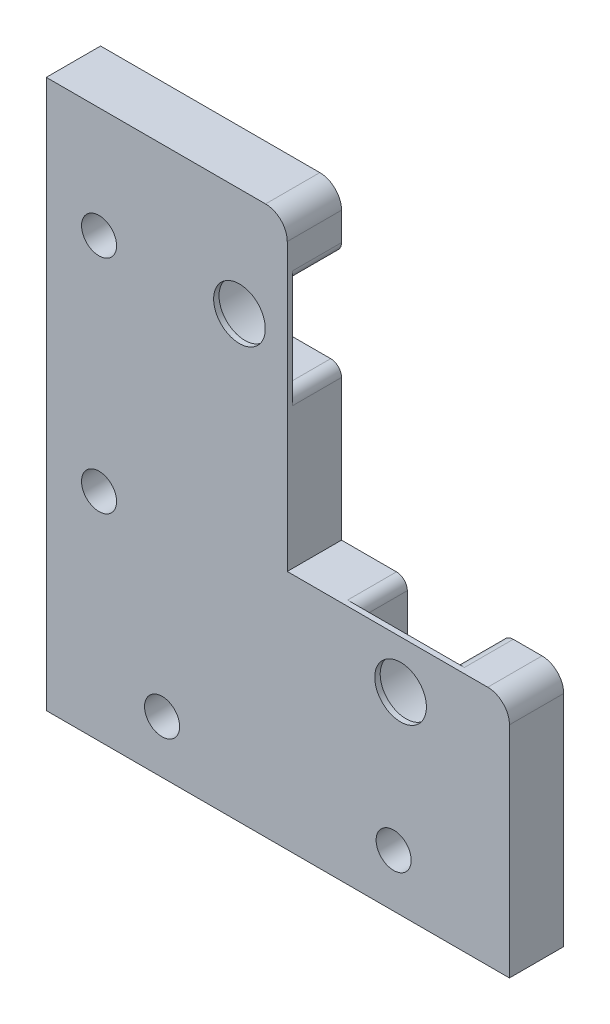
SolidWorks part; units mm, degrees
ref_plane "Front Plane" through (0, 0, 0) normal (0, 0, 1) x (1, 0, 0)
ref_plane "Top Plane" through (0, 0, 0) normal (0, 1, 0) x (1, 0, 0)
ref_plane "Right Plane" through (0, 0, 0) normal (1, 0, 0) x (0, 0, -1)
sketch "Sketch1" plane through (0, 0, 0) normal (0, 0, 1) x (1, 0, 0)
  line L6 (-810.8141, 612.9135) -> (-817.6657, 612.9135)
  line L7 (-810.8141, 612.9135) -> (-779.225, 612.9135)
  line L8 (-493.7649, 564.4955) -> (-493.7649, 1167.7963)
  line L9 (-493.7649, 1167.7963) -> (-817.6657, 1167.7963)
  line L10 (-817.6657, 1167.7963) -> (-817.6657, 564.4955)
  line L11 (-817.6657, 564.4955) -> (-493.7649, 564.4955)
  line L12 (-779.225, 612.9135) -> (-779.225, 571.3471)
  line L13 (-779.225, 571.3471) -> (-779.225, 564.4955)
  circle A2 centre (-798.6157, 583.5455) radius 2.667
extrude "Boss-Extrude1" add sketch "Sketch1" along normal blind 6.35 contours L13 L12 L7 L6 L10 L11 A2
sketch "Sketch2" plane through (0, 0, 6.35) normal (0, 0, 1) x (1, 0, 0)
  line L0 (-779.225, 564.4955) -> (-779.225, 555.0975)
  line L1 (-817.6657, 612.9135) -> (-827.0637, 612.9135)
  line L3 (-827.0637, 612.9135) -> (-779.225, 612.9135)
  line L4 (-779.225, 564.4955) -> (-779.225, 612.9135)
  line L5 (-779.225, 612.9135) -> (-817.6657, 612.9135)
  line L6 (-817.6657, 612.9135) -> (-817.6657, 564.4955)
  line L7 (-817.6657, 564.4955) -> (-779.225, 564.4955)
  line L8 (-779.225, 564.4955) -> (-779.225, 612.9135)
  line L9 (-779.225, 612.9135) -> (-817.6657, 612.9135)
  line L10 (-817.6657, 612.9135) -> (-817.6657, 564.4955)
  line L11 (-817.6657, 564.4955) -> (-779.225, 564.4955)
  line L12 (-827.0637, 612.9135) -> (-827.0637, 555.0975)
  line L13 (-827.0637, 555.0975) -> (-779.225, 555.0975)
  line L14 (-779.225, 612.9135) -> (-779.225, 555.0975)
  dimension "D2" = 9.398
  dimension "D1" = 0
extrude "Boss-Extrude2" add sketch "Sketch2" against normal up to vertex (996.0964 mm away) contours L12 L13 L0 L1 M15 M14
sketch "Sketch6" plane through (0, 0, 0) normal (0, 0, -1) x (-1, 0, 0)
  line L4 (779.225, 612.9135) -> (779.225, 555.0975)
  line L5 (779.225, 555.0975) -> (827.0637, 555.0975)
  line L6 (827.0637, 555.0975) -> (827.0637, 612.9135)
  line L7 (827.0637, 612.9135) -> (779.225, 612.9135)
  line L8 (779.225, 612.9135) -> (779.225, 555.0975)
  line L9 (779.225, 555.0975) -> (827.0637, 555.0975)
  line L10 (827.0637, 555.0975) -> (827.0637, 612.9135)
  line L11 (827.0637, 612.9135) -> (779.225, 612.9135)
  line L12 (804.9657, 562.1587) -> (817.4117, 562.1587)
  line L14 (819.1897, 562.1587) -> (820.0025, 562.1587)
  line L15 (820.0025, 562.1587) -> (820.0025, 612.9135)
  line L20 (817.4117, 562.1587) -> (819.1897, 562.1587)
  line L21 (804.9657, 562.1587) -> (779.225, 562.1587)
  dimension "D1" = 0
extrude "Boss-Extrude4" add sketch "Sketch6" along normal up to surface (78.0796 mm away) contours L12 L21 L8 L15 L14 L20 M11 M12 M13
sketch "Sketch7" plane through (0, 0, -78.0796) normal (0, 0, -1) x (-1, 0, 0)
  line L6 (805.2197, 576.9415) -> (805.2197, 612.9135)
  line L7 (779.225, 576.9415) -> (804.6609, 576.9415)
  line L8 (820.0025, 612.9135) -> (827.0637, 612.9135)
  line L9 (827.0637, 612.9135) -> (827.0637, 555.0975)
  line L10 (827.0637, 555.0975) -> (779.225, 555.0975)
  line L11 (779.225, 555.0975) -> (779.225, 562.1587)
  line L12 (779.225, 562.1587) -> (779.225, 576.9415)
  line L13 (820.0025, 612.9135) -> (805.2197, 612.9135)
  line L14 (804.6609, 576.9415) -> (805.2197, 576.9415)
  circle A2 centre (791.9609, 571.3471) radius 2.3812
  circle A3 centre (810.8141, 600.2587) radius 2.3812
sketch "Sketch8" plane through (0, 0, -78.0796) normal (0, 0, -1) x (-1, 0, 0)
  line L9 (805.2197, 612.9135) -> (805.2197, 576.9415)
  line L10 (820.0025, 612.9135) -> (805.2197, 612.9135)
  line L11 (827.0637, 612.9135) -> (820.0025, 612.9135)
  line L12 (827.0637, 555.0975) -> (827.0637, 612.9135)
  line L13 (779.225, 555.0975) -> (827.0637, 555.0975)
  line L14 (779.225, 562.1587) -> (779.225, 555.0975)
  line L15 (779.225, 576.9415) -> (779.225, 562.1587)
  line L16 (804.6609, 576.9415) -> (779.225, 576.9415)
  line L17 (805.2197, 576.9415) -> (804.6609, 576.9415)
  line L18 (805.2197, 612.9135) -> (805.2197, 576.9415)
  line L19 (820.0025, 612.9135) -> (805.2197, 612.9135)
  line L20 (827.0637, 612.9135) -> (820.0025, 612.9135)
  line L21 (827.0637, 555.0975) -> (827.0637, 612.9135)
  line L22 (779.225, 555.0975) -> (827.0637, 555.0975)
  line L23 (779.225, 562.1587) -> (779.225, 555.0975)
  line L24 (779.225, 576.9415) -> (779.225, 562.1587)
  line L25 (804.6609, 576.9415) -> (779.225, 576.9415)
  line L26 (805.2197, 576.9415) -> (804.6609, 576.9415)
  circle A1 centre (810.8141, 600.2587) radius 2.3813
  circle A2 centre (810.8141, 600.2587) radius 2.3812
  circle A3 centre (791.9609, 571.3471) radius 2.3813
  circle A4 centre (791.9609, 571.3471) radius 2.3812
  dimension "D1" = 0
  dimension "D2" = 0
  dimension "D3" = 0
extrude "Boss-Extrude6" add sketch "Sketch8" along normal blind 2.54
other "Cavity1"
other "5 SIDED ENCLOSURE 3 INCH.stp<1>@Assem11"
sketch "Sketch9" plane through (0, 612.9135, 0) normal (0, 1, 0) x (1, 0, 0)
  line L0 (-820.7645, 76.454) -> (-820.8153, 73.0504)
  line L1 (-820.8153, 3.1496) -> (-820.8153, 0)
  line L2 (-820.8153, 0) -> (-820.0025, 0)
  line L3 (-820.0025, 76.454) -> (-820.0025, 78.0796)
  line L4 (-820.0025, 78.0796) -> (-820.0025, 0)
  line L5 (-820.8153, 0) -> (-821.0693, 0)
  line L6 (-821.0693, 0) -> (-821.0693, 78.0796)
  line L7 (-821.0693, 78.0796) -> (-820.7645, 78.0796)
  line L12 (-820.7645, 76.454) -> (-820.7645, 78.0796)
  line L13 (-820.7645, 78.0796) -> (-805.2197, 78.0796)
  line L14 (-805.2197, 78.0796) -> (-805.2197, 80.6196)
  line L15 (-805.2197, 80.6196) -> (-827.0637, 80.6196)
  line L16 (-827.0637, 80.6196) -> (-827.0637, -6.35)
  line L17 (-827.0637, -6.35) -> (-779.225, -6.35)
  line L18 (-779.225, -6.35) -> (-779.225, 0)
  line L19 (-779.225, 0) -> (-820.0025, 0)
  line L20 (-820.0025, 0) -> (-820.0025, 1.0379)
  line L21 (-820.8153, 3.1496) -> (-820.8153, 73.0504)
  line L22 (-820.0025, 75.1621) -> (-820.0025, 76.454)
  line L23 (-820.0025, 76.454) -> (-820.7645, 76.454)
  line L24 (-820.7645, 76.454) -> (-820.7645, 78.0796)
  line L25 (-820.7645, 78.0796) -> (-805.2197, 78.0796)
  line L26 (-805.2197, 78.0796) -> (-805.2197, 80.6196)
  line L27 (-805.2197, 80.6196) -> (-827.0637, 80.6196)
  line L28 (-827.0637, 80.6196) -> (-827.0637, -6.35)
  line L29 (-827.0637, -6.35) -> (-779.225, -6.35)
  line L30 (-779.225, -6.35) -> (-779.225, 0)
  line L31 (-779.225, 0) -> (-820.0025, 0)
  line L32 (-820.0025, 0) -> (-820.0025, 1.0379)
  line L33 (-820.8153, 3.1496) -> (-820.8153, 73.0504)
  line L34 (-820.0025, 75.1621) -> (-820.0025, 76.454)
  line L35 (-820.0025, 76.454) -> (-820.7645, 76.454)
  arc A2 (-820.8153, 3.1496) -> (-820.0025, 1.0379) centre (-817.6657, 3.1496) ccw
  arc A3 (-820.0025, 75.1621) -> (-820.8153, 73.0504) centre (-817.6657, 73.0504) ccw
  arc A4 (-820.8153, 3.1496) -> (-820.0025, 1.0379) centre (-817.6657, 3.1496) ccw
  arc A5 (-820.0025, 75.1621) -> (-820.8153, 73.0504) centre (-817.6657, 73.0504) ccw
  dimension "D2" = 0.254
  dimension "D1" = 0
extrude "Cut-Extrude3" cut sketch "Sketch9" against normal up to surface (50.7548 mm away) contours L0 M28 M26 M27 | L7 L6 L5 L1 L0 M25 M26 M15 | L1 L2 M23 M24
sketch "Sketch10" plane through (-779.225, 0, 0) normal (1, 0, 0) x (0, 0, -1)
  line L0 (78.0796, 561.3459) -> (78.0796, 561.0919)
  line L1 (78.0796, 561.0919) -> (0, 561.0919)
  line L2 (0, 561.0919) -> (0, 562.1587)
  line L4 (24.4475, 562.1587) -> (24.4475, 561.3459) construction
  line L5 (24.4475, 562.1587) -> (24.4475, 561.3459)
  line L6 (0, 562.4127) -> (0, 562.1587)
  line L7 (0, 562.4127) -> (78.0796, 562.4127)
  line L8 (76.1963, 562.4127) -> (76.1963, 562.1587)
  line L9 (78.0796, 562.4127) -> (76.1963, 562.4127)
  line L10 (78.0796, 562.4127) -> (78.0796, 565.7277)
  line L11 (78.0796, 565.7277) -> (76.1963, 565.7277)
  line L12 (78.0796, 576.9415) -> (78.0796, 561.3459)
  line L13 (78.0796, 561.3459) -> (76.454, 561.3459)
  line L14 (76.454, 561.3459) -> (76.454, 562.1587)
  line L15 (76.454, 562.1587) -> (75.1621, 562.1587)
  line L16 (73.0504, 561.3459) -> (3.1496, 561.3459)
  line L17 (1.0379, 562.1587) -> (0, 562.1587)
  line L18 (0, 562.1587) -> (0, 612.9135)
  line L19 (0, 612.9135) -> (-6.35, 612.9135)
  line L20 (-6.35, 612.9135) -> (-6.35, 555.0975)
  line L21 (-6.35, 555.0975) -> (80.6196, 555.0975)
  line L22 (80.6196, 555.0975) -> (80.6196, 576.9415)
  line L23 (80.6196, 576.9415) -> (78.0796, 576.9415)
  line L24 (78.0796, 576.9415) -> (78.0796, 561.3459)
  line L25 (78.0796, 561.3459) -> (76.454, 561.3459)
  line L26 (76.454, 561.3459) -> (76.454, 562.1587)
  line L27 (76.454, 562.1587) -> (75.1621, 562.1587)
  line L28 (73.0504, 561.3459) -> (3.1496, 561.3459)
  line L29 (1.0379, 562.1587) -> (0, 562.1587)
  line L30 (0, 562.1587) -> (0, 612.9135)
  line L31 (0, 612.9135) -> (-6.35, 612.9135)
  line L32 (-6.35, 612.9135) -> (-6.35, 555.0975)
  line L33 (-6.35, 555.0975) -> (80.6196, 555.0975)
  line L34 (80.6196, 555.0975) -> (80.6196, 576.9415)
  line L35 (80.6196, 576.9415) -> (78.0796, 576.9415)
  line L36 (76.1963, 562.4127) -> (76.1963, 565.7277)
  line L37 (0, 561.0919) -> (3.4229, 561.0919)
  line L38 (0, 561.0919) -> (0, 564.0863)
  line L39 (0, 564.0863) -> (3.4229, 564.0863)
  line L40 (3.4229, 561.0919) -> (3.4229, 564.0863)
  arc A2 (73.0504, 561.3459) -> (75.1621, 562.1587) centre (73.0504, 564.4955) ccw
  arc A3 (1.0379, 562.1587) -> (3.1496, 561.3459) centre (3.1496, 564.4955) ccw
  arc A4 (73.0504, 561.3459) -> (75.1621, 562.1587) centre (73.0504, 564.4955) ccw
  arc A5 (1.0379, 562.1587) -> (3.1496, 561.3459) centre (3.1496, 564.4955) ccw
  dimension "D2" = 0.254
  dimension "D3" = 0.254
  dimension "D1" = 0
extrude "Cut-Extrude5" cut sketch "Sketch10" against normal up to surface (41.8444 mm away)
sketch "Sketch12" plane through (0, 0, -80.6196) normal (0, 0, -1) x (-1, 0, 0)
  line L6 (827.0637, 612.9135) -> (805.2197, 612.9135)
  line L7 (805.2197, 612.9135) -> (805.2197, 576.9415)
  line L8 (805.2197, 576.9415) -> (779.225, 576.9415)
  line L9 (779.225, 576.9415) -> (779.225, 555.0975)
  line L10 (779.225, 555.0975) -> (827.0637, 555.0975)
  line L11 (827.0637, 555.0975) -> (827.0637, 612.9135)
  line L12 (827.0637, 612.9135) -> (805.2197, 612.9135)
  line L13 (805.2197, 612.9135) -> (805.2197, 576.9415)
  line L14 (805.2197, 576.9415) -> (779.225, 576.9415)
  line L15 (779.225, 576.9415) -> (779.225, 555.0975)
  line L16 (779.225, 555.0975) -> (827.0637, 555.0975)
  line L17 (827.0637, 555.0975) -> (827.0637, 612.9135)
  circle A1 centre (791.9609, 571.3471) radius 2.3813
  circle A2 centre (791.9609, 571.3471) radius 2.3812
  circle A3 centre (810.8141, 600.2587) radius 2.3813
  circle A4 centre (810.8141, 600.2587) radius 2.3812
  dimension "D1" = 0
  dimension "D2" = 0
  dimension "D3" = 0
extrude "Boss-Extrude7" add sketch "Sketch12" along normal blind 3.81
sketch "Sketch13" plane through (0, 0, -84.4296) normal (0, 0, -1) x (-1, 0, 0)
  line L0 (797.5235, 571.3471) -> (797.5235, 576.9415)
  line L1 (805.2197, 576.9415) -> (779.225, 576.9415) construction
  line L2 (786.3983, 571.3471) -> (786.3983, 576.9415)
  line L3 (810.8141, 594.6961) -> (805.2197, 594.6961)
  line L4 (805.2197, 612.9135) -> (805.2197, 576.9415) construction
  line L5 (810.8141, 605.8213) -> (805.2197, 605.8213)
  line L12 (827.0637, 612.9135) -> (805.2197, 612.9135)
  line L13 (805.2197, 612.9135) -> (805.2197, 576.9415)
  line L14 (805.2197, 576.9415) -> (779.225, 576.9415)
  line L15 (779.225, 576.9415) -> (779.225, 555.0975)
  line L16 (779.225, 555.0975) -> (827.0637, 555.0975)
  line L17 (827.0637, 555.0975) -> (827.0637, 612.9135)
  line L18 (827.0637, 612.9135) -> (805.2197, 612.9135)
  line L19 (805.2197, 612.9135) -> (805.2197, 576.9415)
  line L20 (805.2197, 576.9415) -> (779.225, 576.9415)
  line L21 (779.225, 576.9415) -> (779.225, 555.0975)
  line L22 (779.225, 555.0975) -> (827.0637, 555.0975)
  line L23 (827.0637, 555.0975) -> (827.0637, 612.9135)
  circle A2 centre (810.8141, 600.2587) radius 3.0226
  circle A3 centre (791.9609, 571.3471) radius 3.0226
  circle A4 centre (791.9609, 571.3471) radius 5.5626
  circle A5 centre (810.8141, 600.2587) radius 5.5626
  dimension "D1" = 2.54
  dimension "D2" = 0
extrude "Cut-Extrude7" cut sketch "Sketch13" against normal blind 5.715 contours M16 | A5 A2 | A5 L5 L3 M7 | M3 | A3 M3 | A4 A3 | A4 L0 L2 M9
fillet "Fillet3" radius 1.27 4 edges at (-805.2197, 605.8213, -81.5721) (-805.2197, 594.6961, -81.5721) (-797.5235, 576.9415, -81.5721) (-786.3983, 576.9415, -81.5721)
sketch "Sketch14" plane through (0, 0, 6.35) normal (0, 0, 1) x (1, 0, 0)
  line L4 (-779.225, 612.9135) -> (-827.0637, 612.9135)
  line L5 (-827.0637, 612.9135) -> (-827.0637, 555.0975)
  line L6 (-827.0637, 555.0975) -> (-779.225, 555.0975)
  line L7 (-779.225, 555.0975) -> (-779.225, 612.9135)
  line L8 (-779.225, 612.9135) -> (-827.0637, 612.9135)
  line L9 (-827.0637, 612.9135) -> (-827.0637, 555.0975)
  line L10 (-827.0637, 555.0975) -> (-779.225, 555.0975)
  line L11 (-779.225, 555.0975) -> (-779.225, 612.9135)
  circle A1 centre (-798.6157, 583.5455) radius 12.7
  circle A2 centre (-798.6157, 583.5455) radius 12.954
  dimension "D1" = 0
  dimension "D2" = 0.254
extrude "Cut-Extrude8" cut sketch "Sketch14" against normal blind 5.715 contours A2 A1 | A1 M9 | M9
fillet "Fillet4" radius 2.54 3 edges at (-779.225, 576.9415, -81.2546) (-805.2197, 612.9135, -81.2546) (-779.225, 612.9135, 3.175)
sketch "Sketch15" plane through (0, 0, 6.35) normal (0, 0, 1) x (1, 0, 0)
  line L0 (-779.225, 555.0975) -> (-779.225, 610.3735) construction
  line L1 (-781.765, 612.9135) -> (-827.0637, 612.9135) construction
  line L2 (-827.0637, 612.9135) -> (-827.0637, 555.0975) construction
  line L3 (-827.0637, 555.0975) -> (-779.225, 555.0975) construction
  line L4 (-779.225, 555.0975) -> (-779.225, 610.3735)
  line L5 (-781.765, 612.9135) -> (-827.0637, 612.9135)
  line L6 (-827.0637, 612.9135) -> (-827.0637, 555.0975)
  line L7 (-827.0637, 555.0975) -> (-779.225, 555.0975)
  arc A1 (-779.225, 610.3735) -> (-781.765, 612.9135) centre (-781.765, 610.3735) ccw construction
  arc A3 (-779.225, 610.3735) -> (-781.765, 612.9135) centre (-781.765, 610.3735) ccw
extrude "Cut-Extrude10" cut sketch "Sketch15" against normal up to surface (84.4296 mm away)
sketch "Sketch16" plane through (0, 0, -84.4296) normal (0, 0, -1) x (-1, 0, 0)
  line L8 (827.0637, 612.9135) -> (827.0637, 555.0975)
  line L9 (827.0637, 555.0975) -> (833.4137, 555.0975)
  line L10 (833.4137, 555.0975) -> (833.4137, 612.9135)
  line L11 (833.4137, 612.9135) -> (827.0637, 612.9135)
  line L12 (785.1283, 576.9415) -> (781.765, 576.9415)
  line L13 (779.225, 574.4015) -> (779.225, 555.0975)
  line L14 (779.225, 555.0975) -> (827.0637, 555.0975)
  line L15 (827.0637, 555.0975) -> (827.0637, 612.9135)
  line L16 (827.0637, 612.9135) -> (807.7597, 612.9135)
  line L17 (805.2197, 610.3735) -> (805.2197, 607.0913)
  line L18 (806.4897, 605.8213) -> (810.8141, 605.8213)
  line L19 (810.8141, 594.6961) -> (806.4897, 594.6961)
  line L20 (805.2197, 593.4261) -> (805.2197, 576.9415)
  line L21 (805.2197, 576.9415) -> (798.7935, 576.9415)
  line L22 (797.5235, 575.6715) -> (797.5235, 571.3471)
  line L23 (786.3983, 571.3471) -> (786.3983, 575.6715)
  line L24 (785.1283, 576.9415) -> (781.765, 576.9415)
  line L25 (779.225, 574.4015) -> (779.225, 555.0975)
  line L26 (779.225, 555.0975) -> (827.0637, 555.0975)
  line L27 (827.0637, 555.0975) -> (827.0637, 612.9135)
  line L28 (827.0637, 612.9135) -> (807.7597, 612.9135)
  line L29 (805.2197, 610.3735) -> (805.2197, 607.0913)
  line L30 (806.4897, 605.8213) -> (810.8141, 605.8213)
  line L31 (810.8141, 594.6961) -> (806.4897, 594.6961)
  line L32 (805.2197, 593.4261) -> (805.2197, 576.9415)
  line L33 (805.2197, 576.9415) -> (798.7935, 576.9415)
  line L34 (797.5235, 575.6715) -> (797.5235, 571.3471)
  line L35 (786.3983, 571.3471) -> (786.3983, 575.6715)
  line L36 (833.4137, 548.7475) -> (833.4137, 555.0975)
  line L37 (833.4137, 555.0975) -> (779.225, 555.0975)
  line L38 (779.225, 555.0975) -> (779.225, 548.7475)
  line L39 (779.225, 548.7475) -> (833.4137, 548.7475)
  arc A8 (781.765, 576.9415) -> (779.225, 574.4015) centre (781.765, 574.4015) ccw
  arc A9 (807.7597, 612.9135) -> (805.2197, 610.3735) centre (807.7597, 610.3735) ccw
  arc A10 (805.2197, 607.0913) -> (806.4897, 605.8213) centre (806.4897, 607.0913) ccw
  arc A11 (810.8141, 594.6961) -> (810.8141, 605.8213) centre (810.8141, 600.2587) ccw
  arc A12 (806.4897, 594.6961) -> (805.2197, 593.4261) centre (806.4897, 593.4261) ccw
  arc A13 (798.7935, 576.9415) -> (797.5235, 575.6715) centre (798.7935, 575.6715) ccw
  arc A14 (786.3983, 571.3471) -> (797.5235, 571.3471) centre (791.9609, 571.3471) ccw
  arc A15 (786.3983, 575.6715) -> (785.1283, 576.9415) centre (785.1283, 575.6715) ccw
  arc A16 (781.765, 576.9415) -> (779.225, 574.4015) centre (781.765, 574.4015) ccw
  arc A17 (807.7597, 612.9135) -> (805.2197, 610.3735) centre (807.7597, 610.3735) ccw
  arc A18 (805.2197, 607.0913) -> (806.4897, 605.8213) centre (806.4897, 607.0913) ccw
  arc A19 (810.8141, 594.6961) -> (810.8141, 605.8213) centre (810.8141, 600.2587) ccw
  arc A20 (806.4897, 594.6961) -> (805.2197, 593.4261) centre (806.4897, 593.4261) ccw
  arc A21 (798.7935, 576.9415) -> (797.5235, 575.6715) centre (798.7935, 575.6715) ccw
  arc A22 (786.3983, 571.3471) -> (797.5235, 571.3471) centre (791.9609, 571.3471) ccw
  arc A23 (786.3983, 575.6715) -> (785.1283, 576.9415) centre (785.1283, 575.6715) ccw
  dimension "D1" = 0
extrude "Boss-Extrude8" add sketch "Sketch16" against normal up to surface (6.35 mm away) contours L38 L39 L36 L9 M24 | L10 L11 L9 M25
sketch "Sketch18" plane through (0, 0, -84.4296) normal (0, 0, -1) x (-1, 0, 0)
  line L0 (827.2415, 587.0027) -> (832.4611, 587.0027)
  line L8 (779.225, 561.0919) -> (779.225, 548.7475)
  line L9 (779.225, 548.7475) -> (833.4137, 548.7475)
  line L10 (833.4137, 548.7475) -> (833.4137, 561.0919)
  line L11 (833.4137, 561.0919) -> (821.0693, 561.0919)
  line L12 (833.4137, 548.7475) -> (833.4137, 612.9135)
  line L13 (833.4137, 612.9135) -> (807.7597, 612.9135)
  line L14 (805.2197, 610.3735) -> (805.2197, 607.0913)
  line L15 (806.4897, 605.8213) -> (810.8141, 605.8213)
  line L16 (810.8141, 594.6961) -> (806.4897, 594.6961)
  line L17 (805.2197, 593.4261) -> (805.2197, 576.9415)
  line L18 (805.2197, 576.9415) -> (798.7935, 576.9415)
  line L19 (797.5235, 575.6715) -> (797.5235, 571.3471)
  line L20 (786.3983, 571.3471) -> (786.3983, 575.6715)
  line L21 (785.1283, 576.9415) -> (781.765, 576.9415)
  line L22 (779.225, 574.4015) -> (779.225, 548.7475)
  line L23 (779.225, 548.7475) -> (833.4137, 548.7475)
  line L24 (833.4137, 548.7475) -> (833.4137, 612.9135)
  line L25 (833.4137, 612.9135) -> (807.7597, 612.9135)
  line L26 (805.2197, 610.3735) -> (805.2197, 607.0913)
  line L27 (806.4897, 605.8213) -> (810.8141, 605.8213)
  line L28 (810.8141, 594.6961) -> (806.4897, 594.6961)
  line L29 (805.2197, 593.4261) -> (805.2197, 576.9415)
  line L30 (805.2197, 576.9415) -> (798.7935, 576.9415)
  line L31 (797.5235, 575.6715) -> (797.5235, 571.3471)
  line L32 (786.3983, 571.3471) -> (786.3983, 575.6715)
  line L33 (785.1283, 576.9415) -> (781.765, 576.9415)
  line L34 (779.225, 574.4015) -> (779.225, 548.7475)
  line L35 (779.225, 548.7475) -> (833.4137, 548.7475)
  line L36 (779.225, 554.9197) -> (806.3194, 554.9197) construction
  line L37 (827.2415, 587.0027) -> (827.2415, 612.9135) construction
  line L38 (806.3194, 554.9197) -> (806.3194, 551.5017)
  line L40 (821.0693, 561.0919) -> (833.4137, 561.0919)
  line L41 (833.4137, 561.0919) -> (833.4137, 612.9135)
  line L42 (833.4137, 612.9135) -> (821.0693, 612.9135)
  line L43 (821.0693, 612.9135) -> (821.0693, 561.0919)
  circle A0 centre (792.7722, 554.9197) radius 2.05
  circle A1 centre (827.2415, 599.9581) radius 2.05
  circle A2 centre (819.8666, 554.9197) radius 2.05
  circle A3 centre (827.2415, 574.0473) radius 2.05
  arc A8 (807.7597, 612.9135) -> (805.2197, 610.3735) centre (807.7597, 610.3735) ccw
  arc A9 (805.2197, 607.0913) -> (806.4897, 605.8213) centre (806.4897, 607.0913) ccw
  arc A10 (810.8141, 594.6961) -> (810.8141, 605.8213) centre (810.8141, 600.2587) ccw
  arc A11 (806.4897, 594.6961) -> (805.2197, 593.4261) centre (806.4897, 593.4261) ccw
  arc A12 (798.7935, 576.9415) -> (797.5235, 575.6715) centre (798.7935, 575.6715) ccw
  arc A13 (786.3983, 571.3471) -> (797.5235, 571.3471) centre (791.9609, 571.3471) ccw
  arc A14 (786.3983, 575.6715) -> (785.1283, 576.9415) centre (785.1283, 575.6715) ccw
  arc A15 (781.765, 576.9415) -> (779.225, 574.4015) centre (781.765, 574.4015) ccw
  arc A16 (807.7597, 612.9135) -> (805.2197, 610.3735) centre (807.7597, 610.3735) ccw
  arc A17 (805.2197, 607.0913) -> (806.4897, 605.8213) centre (806.4897, 607.0913) ccw
  arc A18 (810.8141, 594.6961) -> (810.8141, 605.8213) centre (810.8141, 600.2587) ccw
  arc A19 (806.4897, 594.6961) -> (805.2197, 593.4261) centre (806.4897, 593.4261) ccw
  arc A20 (798.7935, 576.9415) -> (797.5235, 575.6715) centre (798.7935, 575.6715) ccw
  arc A21 (786.3983, 571.3471) -> (797.5235, 571.3471) centre (791.9609, 571.3471) ccw
  arc A22 (786.3983, 575.6715) -> (785.1283, 576.9415) centre (785.1283, 575.6715) ccw
  arc A23 (781.765, 576.9415) -> (779.225, 574.4015) centre (781.765, 574.4015) ccw
  point P29 (792.7722, 554.9197)
  point P33 (827.2415, 599.9581)
  dimension "D3" = 4.1
  dimension "D1" = 0
extrude "Cut-Extrude11" cut sketch "Sketch18" against normal through all contours A0 | A2 | A3 | A1
chamfer "Chamfer1" distance 1.27 angle 45 4 edges at (-829.2915, 599.9581, -84.4296) (-829.2915, 574.0473, -84.4296) (-821.9166, 554.9197, -84.4296) (-794.8222, 554.9197, -84.4296)
